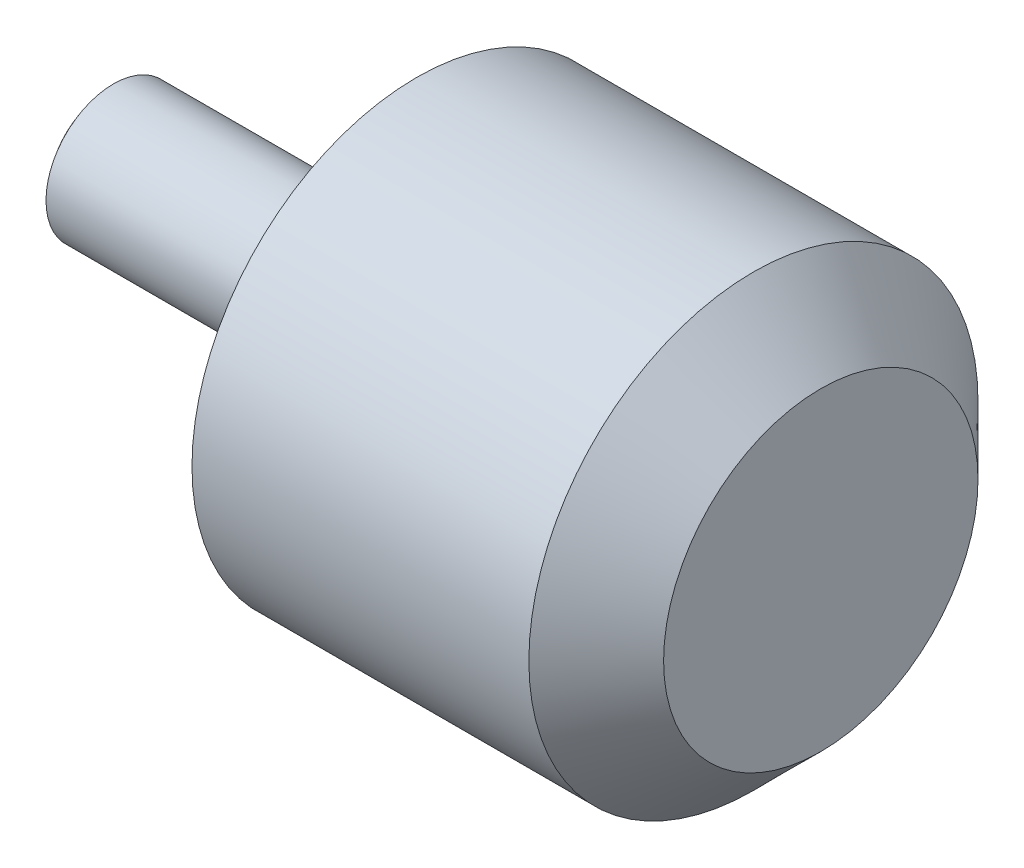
SolidWorks part; units mm, degrees
ref_plane "Front" through (0, 0, 0) normal (0, 0, 1) x (1, 0, 0)
ref_plane "Top" through (0, 0, 0) normal (0, 1, 0) x (1, 0, 0)
ref_plane "Right" through (0, 0, 0) normal (1, 0, 0) x (0, 0, -1)
sketch "Sketch1" plane through (0, 0, 0) normal (0, 1, 0) x (1, 0, 0)
  line L0 (0, 0) -> (32.5729, 0)
  line L1 (32.5729, 0) -> (32.5729, 7)
  line L2 (29.5729, 10) -> (14.5729, 10)
  line L3 (14.5729, 10) -> (14.5729, 5)
  line L4 (14.5729, 5) -> (11.0729, 5)
  line L5 (11.0729, 5) -> (11.0729, 3)
  line L6 (11.0729, 3) -> (1.0729, 3)
  line L10 (29.5729, 10) -> (32.5729, 7)
  arc A0 (1.0729, 3) -> (0, 0) centre (4.7306, 0) ccw
  dimension "D9" = 4.7306
  dimension "D1" = 3
  dimension "D2" = 15
  dimension "D3" = 3.5
  dimension "D4" = 10
  dimension "D5" = 3
  dimension "D6" = 10
  dimension "D7" = 5
  dimension "D8" = 3
revolve "Revolve1" add sketch "Sketch1" angle 360 about L0
